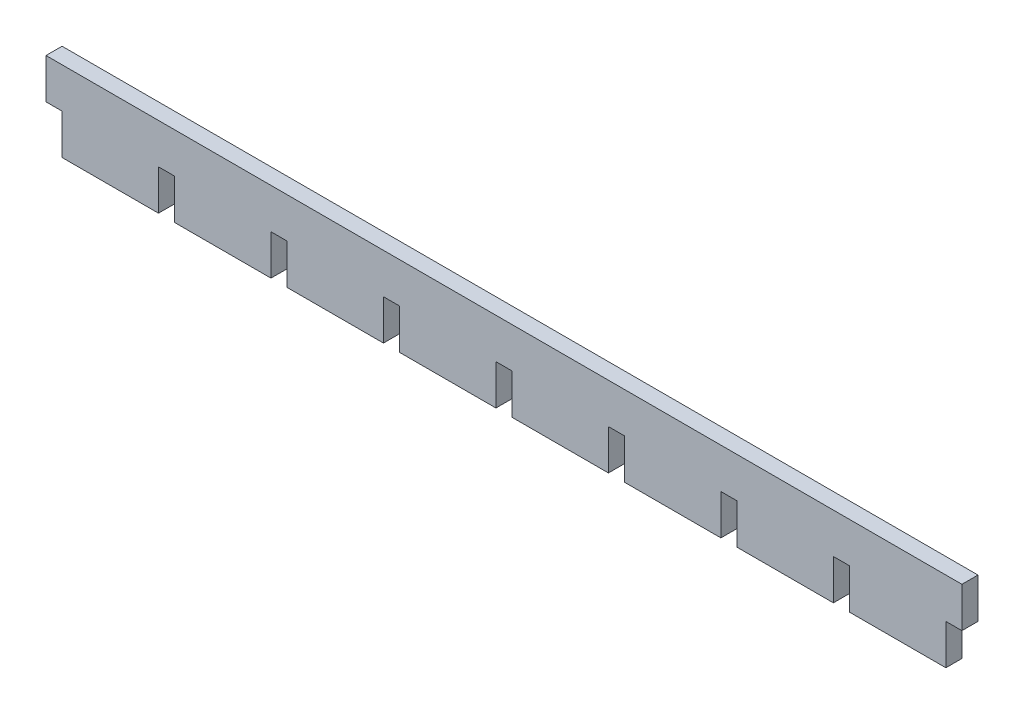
SolidWorks part; units mm, degrees
ref_plane "Front Plane" through (0, 0, 0) normal (0, 0, 1) x (1, 0, 0)
ref_plane "Top Plane" through (0, 0, 0) normal (0, 1, 0) x (1, 0, 0)
ref_plane "Right Plane" through (0, 0, 0) normal (1, 0, 0) x (0, 0, -1)
sketch "Sketch1" plane through (0, 0, 0) normal (0, 0, 1) x (1, 0, 0)
  line L1 (0, 0) -> (342, 0)
  line L2 (0, 0) -> (0, 30)
  line L3 (0, 30) -> (342, 30)
  line L4 (342, 0) -> (342, 30)
  line L6 (0, 30) -> (0, 15)
  line L7 (0, 15) -> (6, 15)
  line L40 (48, 15) -> (42, 15)
  line L41 (6, 15) -> (0, 15)
  line L42 (6, 15) -> (6, 0)
  line L43 (6, 0) -> (0, 0)
  line L44 (0, 15) -> (0, 0)
  line L45 (48, 15) -> (48, 0)
  line L46 (48, 0) -> (42, 0)
  line L47 (42, 15) -> (42, 0)
  line L48 (90, 15) -> (84, 15)
  line L49 (90, 15) -> (90, 0)
  line L50 (90, 0) -> (84, 0)
  line L51 (84, 15) -> (84, 0)
  line L52 (132, 15) -> (126, 15)
  line L53 (132, 15) -> (132, 0)
  line L54 (132, 0) -> (126, 0)
  line L55 (126, 15) -> (126, 0)
  line L56 (174, 15) -> (168, 15)
  line L57 (174, 15) -> (174, 0)
  line L58 (174, 0) -> (168, 0)
  line L59 (168, 15) -> (168, 0)
  line L60 (216, 15) -> (210, 15)
  line L61 (216, 15) -> (216, 0)
  line L62 (216, 0) -> (210, 0)
  line L63 (210, 15) -> (210, 0)
  line L64 (258, 15) -> (252, 15)
  line L65 (258, 15) -> (258, 0)
  line L66 (258, 0) -> (252, 0)
  line L67 (252, 15) -> (252, 0)
  line L68 (300, 15) -> (294, 15)
  line L69 (300, 15) -> (300, 0)
  line L70 (300, 0) -> (294, 0)
  line L71 (294, 15) -> (294, 0)
  line L72 (342, 15) -> (336, 15)
  line L73 (342, 15) -> (342, 0)
  line L74 (342, 0) -> (336, 0)
  line L75 (336, 15) -> (336, 0)
extrude "Boss-Extrude1" add sketch "Sketch1" along normal blind 6
equation "\"sheetThickness\"=0.63mm"
equation "\"flange\"= 11mm"
equation "\"baffleCutWidth\"= 28.58mm"
equation "\"baffleCutLength\"= 146.22mm"
equation "\"metalLength\" = 156.28mm"
equation "\"metalWidth\" = 35.5mm"
equation "\"pitch\" = 42mm"
equation "\"cabDepth\" = 130mm "
equation "\"D6@Sketch1\"=\"pitch\""
equation "\"D1@Boss-Extrude1\"=9*\"pitch\""
equation "\"D2@Sketch1\"=8*\"pitch\"+6"
